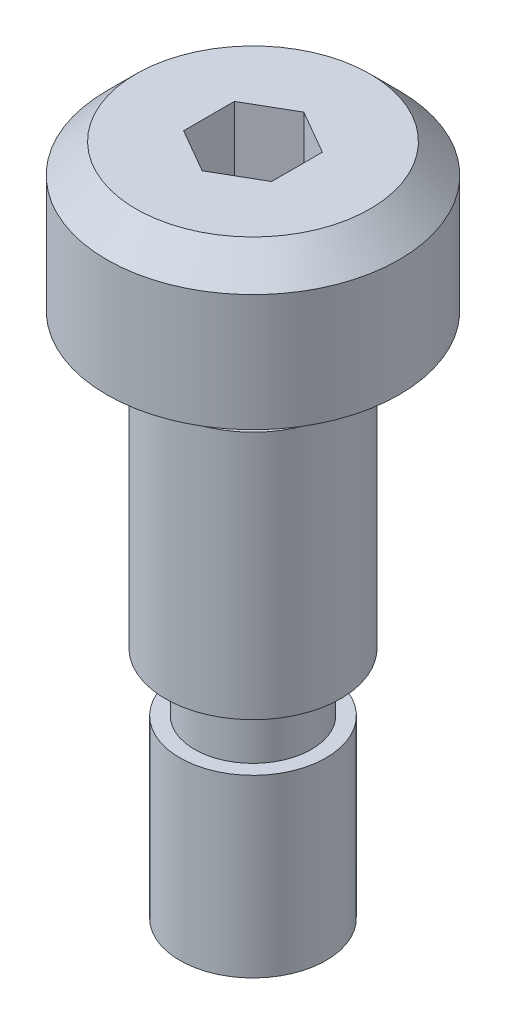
SolidWorks part; units mm, degrees
ref_plane "Plane1" through (0, 0, 0) normal (0, 0, 1) x (1, 0, 0)
ref_plane "Plane2" through (0, 0, 0) normal (0, 1, 0) x (1, 0, 0)
ref_plane "Plane3" through (0, 0, 0) normal (1, 0, 0) x (0, 0, -1)
sketch "Sketch2" plane through (0, 0, 0) normal (0, 0, 1) x (1, 0, 0)
  line L0 (0, 0) -> (7.9375, 0)
  line L1 (7.9375, 0) -> (7.9375, 6.35)
  line L2 (7.9375, 6.35) -> (6.35, 7.9375)
  line L3 (6.35, 7.9375) -> (0, 7.9375)
  line L4 (0, 7.9375) -> (0, 0)
  line L5 (0, 0) -> (0, 103.0583) construction
  dimension "D1" = 6.35
  dimension "D2" = 6.35
  dimension "D3" = 7.9375
  dimension "D4" = 135
revolve "Base-Revolve" add sketch "Sketch2" angle 360 about L5
sketch "Sketch3" plane through (0, 0, 0) normal (0, 0, 1) x (1, 0, 0)
  line L0 (0, 0) -> (0, 100) construction
  line L1 (0, -28.575) -> (3.9688, -28.575)
  line L2 (3.9688, -28.575) -> (3.9688, -19.05)
  line L3 (3.9688, -19.05) -> (3.175, -19.05)
  line L4 (3.175, -19.05) -> (3.175, -15.875)
  line L5 (3.175, -15.875) -> (4.7625, -15.875)
  line L6 (4.7625, -15.875) -> (4.7625, -2.3622)
  line L7 (4.7625, -2.3622) -> (4.445, -2.3622)
  line L8 (4.445, -2.3622) -> (4.445, 0)
  line L9 (4.445, 0) -> (0, 0)
  line L10 (0, 0) -> (0, -28.575)
  dimension "D1" = 15.875
  dimension "D2" = 12.7
  dimension "D3" = 7.9375
  dimension "D4" = 6.35
  dimension "D5" = 9.525
  dimension "D6" = 8.89
  dimension "D7" = 3.175
revolve "Boss-Revolve1" add sketch "Sketch3" angle 360 about L0
ref_plane "Plane4" through (0, 6.35, 0) normal (0, 1, 0) x (-1, 0, 0)
sketch "Sketch4" plane through (0, 7.9375, 0) normal (0, 1, 0) x (-1, 0, 0)
  line L0 (2.3876, 1.3785) -> (0, 2.757)
  line L1 (0, 2.757) -> (-2.3876, 1.3785)
  line L2 (-2.3876, 1.3785) -> (-2.3876, -1.3785)
  line L3 (-2.3876, -1.3785) -> (0, -2.757)
  line L4 (0, -2.757) -> (2.3876, -1.3785)
  line L5 (2.3876, -1.3785) -> (2.3876, 1.3785)
extrude "Cut-Extrude1" cut sketch "Sketch4" against normal blind 3.5814
